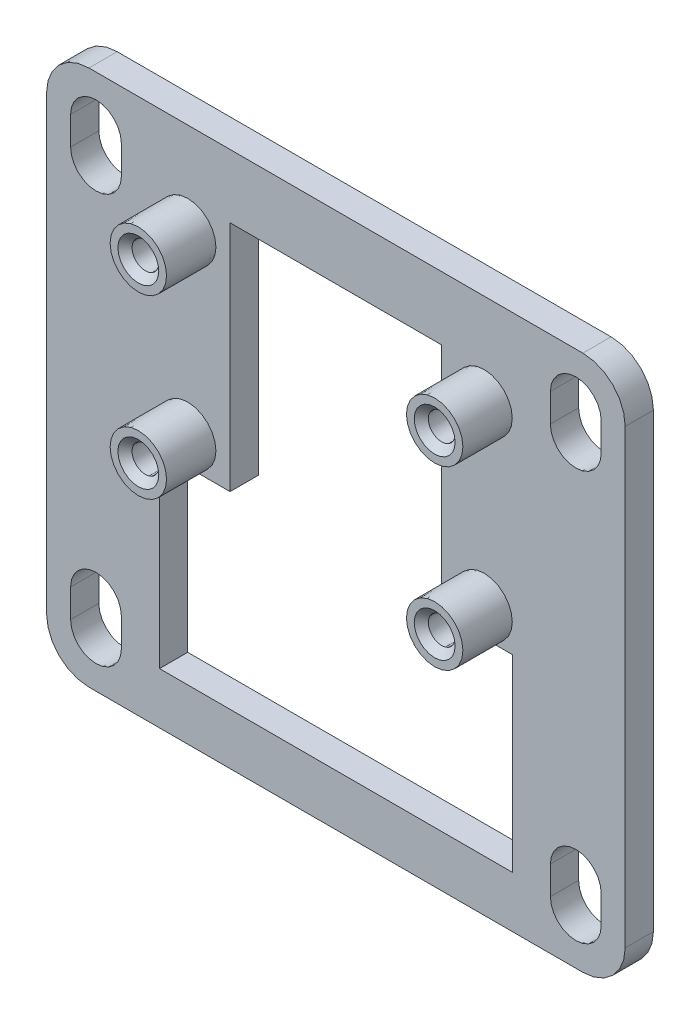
SolidWorks part; units mm, degrees
ref_plane "Ebene vorne" through (0, 0, 0) normal (0, 0, 1) x (1, 0, 0)
ref_plane "Ebene oben" through (0, 0, 0) normal (0, 1, 0) x (1, 0, 0)
ref_plane "Ebene rechts" through (0, 0, 0) normal (1, 0, 0) x (0, 0, -1)
sketch "Skizze1" plane through (0, 0, 0) normal (0, 0, 1) x (1, 0, 0)
  line L0 (0, -55) -> (0, 55) construction
  line L7 (-17.5, -19) -> (17.5, -19)
  line L8 (-20.5, -16) -> (-20.5, 16)
  line L9 (-17.5, 19) -> (17.5, 19)
  line L10 (20.5, -16) -> (20.5, 16)
  line L11 (-20.5, -19) -> (20.5, 19) construction
  line L12 (-20.5, 19) -> (20.5, -19) construction
  line L15 (-7.5, 14.5) -> (-7.5, -2)
  line L21 (-7.5, -2) -> (-13, -2)
  line L23 (-13, -2) -> (-13, -15.5)
  line L24 (-13, -15.5) -> (13, -15.5)
  line L25 (0, -15.5) -> (0, 14.5) construction
  line L26 (7.5, 14.5) -> (-7.5, 14.5)
  line L28 (13, -2) -> (13, -15.5)
  line L29 (7.5, -2) -> (13, -2)
  line L30 (7.5, 14.5) -> (7.5, -2)
  arc A2 (17.5, 19) -> (20.5, 16) centre (17.5, 16) cw
  arc A3 (17.5, -19) -> (20.5, -16) centre (17.5, -16) ccw
  arc A4 (-17.5, -19) -> (-20.5, -16) centre (-17.5, -16) cw
  arc A5 (-20.5, 16) -> (-17.5, 19) centre (-17.5, 16) cw
  dimension "D6" = 3
  dimension "D1" = 41
  dimension "D2" = 38
  dimension "D3" = 3.5
  dimension "D4" = 4.5
  dimension "D5" = 15
  dimension "D7" = 7.5
  dimension "D8" = 13.5
  dimension "D9" = 26
extrude "Aufsatz-Linear austragen1" add sketch "Skizze1" along normal blind 2
sketch "Skizze6" plane through (0, 0, 2) normal (0, 0, 1) x (1, 0, 0)
  circle A0 centre (-10.5, 12.5) radius 2
  circle A1 centre (-10.5, 0) radius 2
  circle A2 centre (10.5, 0) radius 2
  circle A3 centre (10.5, 12.5) radius 2
  dimension "D1" = 4
extrude "Aufsatz-Linear austragen2" add sketch "Skizze6" along normal blind 3.5
hole_wizard "Ø1.9 (1.9) Durchmesser Bohrung1" positions "Skizze2" profile "Skizze3" hole size "Ø1.9" standard "DIN"
sketch "Skizze2" plane through (0, 0, 0) normal (0, 0, 1) x (1, 0, 0)
  point P0 (-10.5, 12.5)
  point P2 (-10.5, 0)
  point P4 (10.5, 0)
  point P6 (10.5, 12.5)
sketch "Skizze3" plane through (-10.5, 12.5, 0) normal (1, 0, 0) x (0, 1, 0)
  line L0 (0, 0) -> (0, 5.5)
  line L1 (0, 5.5) -> (0.95, 5.5)
  line L2 (0.95, 5.5) -> (0.95, 0)
  line L5 (0.95, 0) -> (0, 0)
  line L11 (0, -6.35) -> (0, 107.95) construction
  dimension "Bohrerdurchmesser" = 1.9
  dimension "Bohrungstiefe" = 5.5
hole_wizard "Durchgangsloch für M34" positions "Skizze4" profile "Skizze5" size "M3" standard "DIN"
sketch "Skizze4" plane through (0, 0, 0) normal (0, 0, 1) x (1, 0, 0)
  line L1 (-17, -14.5) -> (17, -14.5)
  line L2 (-17, -14.5) -> (-17, 14.5)
  line L3 (-17, 14.5) -> (17, 14.5)
  line L4 (17, -14.5) -> (17, 14.5)
  line L5 (-17, -14.5) -> (17, 14.5) construction
  line L6 (-17, 14.5) -> (17, -14.5) construction
  line L7 (-17, 13.5) -> (-17, 15.5) construction
  point P0 (-17, 14.5)
  point P2 (17, 14.5)
  point P4 (17, -14.5)
  point P6 (-17, -14.5)
  dimension "D1" = 34
  dimension "D2" = 29
  dimension "D3" = 2
sketch "Skizze5" plane through (-17, 14.5, 0) normal (1, 0, 0) x (0, 1, 0)
  line L0 (0, 0) -> (0, 5.5)
  line L1 (0, 5.5) -> (1.8, 5.5)
  line L2 (1.8, 5.5) -> (1.8, 0)
  line L5 (1.8, 0) -> (0, 0)
  line L11 (0, -6.35) -> (0, 107.95) construction
  dimension "Bohrerdurchmesser" = 3.6
  dimension "Bohrungstiefe" = 5.5
chamfer "Fase1" distance 0.5 angle 45 4 edges at (-11.45, 0, 5.5) (9.55, 0, 5.5) (9.55, 12.5, 5.5) (-11.45, 12.5, 5.5)
